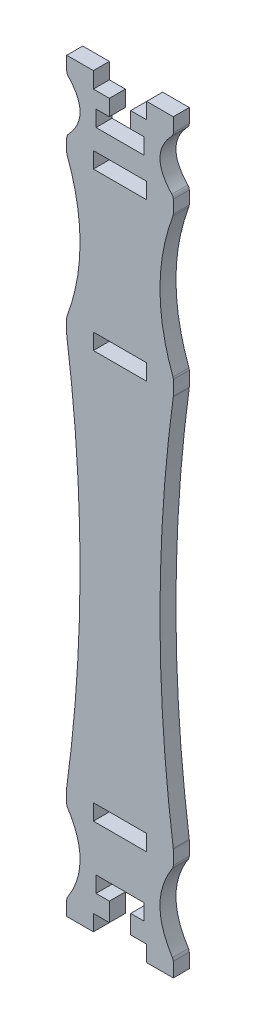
SolidWorks part; units mm, degrees
ref_plane "Alzado" through (0, 0, 0) normal (0, 0, 1) x (1, 0, 0)
ref_plane "Planta" through (0, 0, 0) normal (0, 1, 0) x (1, 0, 0)
ref_plane "Vista lateral" through (0, 0, 0) normal (1, 0, 0) x (0, 0, -1)
sketch "Croquis1" plane through (0, 0, 0) normal (0, 0, 1) x (1, 0, 0)
  line L0 (-15, -70) -> (-10, -70)
  line L1 (-10, 70) -> (-10, 67)
  line L2 (-7, 67) -> (-10, 67)
  line L3 (0, -70) -> (5, -70)
  line L4 (-15, 70) -> (-15, 67.4057)
  line L5 (0, -70) -> (0, -67)
  line L6 (-7, -63.5) -> (-7, -67)
  line L7 (-0.5, -60.5) -> (-9.5, -60.5)
  line L8 (-10, -67) -> (-10, -70)
  line L9 (-10, 70) -> (-15, 70)
  line L10 (-9.5, 61) -> (-0.5, 61)
  line L11 (-10, -52) -> (-10, -49)
  line L12 (-10, -52) -> (0, -52)
  line L13 (-0.5, -60.5) -> (-0.5, -63.5)
  line L14 (-0.5, -63.5) -> (-3, -63.5)
  line L15 (-10, -49) -> (0, -49)
  line L16 (0, -49) -> (0, -52)
  line L17 (-0.5, 61) -> (-0.5, 64)
  line L18 (-3, -63.5) -> (-3, -67)
  line L19 (-0.5, 64) -> (-3, 64)
  line L20 (-10, 27.5) -> (-10, 24.5)
  line L21 (-3, 64) -> (-3, 67)
  line L22 (-10, 24.5) -> (0, 24.5)
  line L23 (0, 24.5) -> (0, 27.5)
  line L24 (-7, 64) -> (-7, 67)
  line L25 (-15, 27.3187) -> (-15, 24.5677)
  line L26 (-9.5, -63.5) -> (-7, -63.5)
  line L27 (-9.5, -60.5) -> (-9.5, -63.5)
  line L28 (-7, -67) -> (-10, -67)
  line L29 (-9.5, 64) -> (-7, 64)
  line L30 (-9.5, 61) -> (-9.5, 64)
  line L31 (-10, 54) -> (-10, 57)
  line L32 (-10, 54) -> (0, 54)
  line L33 (-10, 57) -> (0, 57)
  line L34 (0, 57) -> (0, 54)
  line L35 (-3, 67) -> (0, 67)
  line L37 (0, 67) -> (0, 70)
  line L38 (5, 70) -> (0, 70)
  line L40 (0, 27.5) -> (-10, 27.5)
  line L42 (-15, 56.5943) -> (-15, 54.1813)
  line L43 (0, -67) -> (-3, -67)
  line L46 (-15, -49.0677) -> (-15, -51.7014)
  line L48 (-15, -67.2986) -> (-15, -70)
  line L49 (5, -70) -> (5, -67.2986)
  line L51 (5, -51.7014) -> (5, -49.0677)
  line L53 (5, 24.5677) -> (5, 27.3187)
  line L55 (5, 54.1813) -> (5, 56.5943)
  line L57 (5, 67.4057) -> (5, 70)
  arc A0 (-14.8403, -66.7566) -> (-15, -67.2986) centre (-14, -67.2986) ccw
  arc A1 (5, -67.2986) -> (4.8403, -66.7566) centre (4, -67.2986) ccw
  arc A2 (4.8403, -52.2434) -> (5, -51.7014) centre (4, -51.7014) ccw
  arc A3 (-15, -51.7014) -> (-14.8403, -52.2434) centre (-14, -51.7014) ccw
  arc A4 (-14.9909, -48.9331) -> (-15, -49.0677) centre (-14, -49.0677) ccw
  arc A5 (5, -49.0677) -> (4.9909, -48.9331) centre (4, -49.0677) ccw
  arc A6 (-15, 24.5677) -> (-14.9909, 24.4331) centre (-14, 24.5677) ccw
  arc A7 (4.9909, 24.4331) -> (5, 24.5677) centre (4, 24.5677) ccw
  arc A8 (-14.9371, 27.6678) -> (-15, 27.3187) centre (-14, 27.3187) ccw
  arc A9 (5, 27.3187) -> (4.9371, 27.6678) centre (4, 27.3187) ccw
  arc A10 (-14.7272, 57.2807) -> (-15, 56.5943) centre (-14, 56.5943) ccw
  arc A11 (-15, 54.1813) -> (-14.9371, 53.8322) centre (-14, 54.1813) ccw
  arc A12 (4.9371, 53.8322) -> (5, 54.1813) centre (4, 54.1813) ccw
  arc A13 (5, 56.5943) -> (4.7272, 57.2807) centre (4, 56.5943) ccw
  arc A14 (4.7272, 66.7193) -> (5, 67.4057) centre (4, 67.4057) ccw
  arc A15 (-15, 67.4057) -> (-14.7272, 66.7193) centre (-14, 67.4057) ccw
  spline S0 degree 3 poles (4.7272, 66.7193) (3.2424, 65.1462) (1.7576, 62) (3.2424, 58.8538) (4.7272, 57.2807) knots 0.028065 0.028065 0.028065 0.028065 0.5 0.971935 0.971935 0.971935 0.971935
  spline S1 degree 3 poles (-14.7272, 57.2807) (-13.2424, 58.8538) (-11.7576, 62) (-13.2424, 65.1462) (-14.7272, 66.7193) knots 0.028065 0.028065 0.028065 0.028065 0.5 0.971935 0.971935 0.971935 0.971935
  spline S2 degree 3 poles (-14.9371, 53.8322) (-13.3124, 49.4715) (-11.6876, 40.75) (-13.3124, 32.0285) (-14.9371, 27.6678) knots 0.006333 0.006333 0.006333 0.006333 0.5 0.993667 0.993667 0.993667 0.993667
  spline S3 degree 3 poles (4.9371, 53.8322) (3.3124, 49.4715) (1.6876, 40.75) (3.3124, 32.0285) (4.9371, 27.6678) knots 0.006333 0.006333 0.006333 0.006333 0.5 0.993667 0.993667 0.993667 0.993667
  spline S4 degree 3 poles (-14.9909, -48.9331) (-13.3303, -36.7054) (-11.6697, -12.25) (-13.3303, 12.2054) (-14.9909, 24.4331) knots 0.00091 0.00091 0.00091 0.00091 0.5 0.99909 0.99909 0.99909 0.99909
  spline S5 degree 3 poles (4.8403, -66.7566) (3.2801, -64.3377) (1.7199, -59.5) (3.2801, -54.6623) (4.8403, -52.2434) knots 0.016229 0.016229 0.016229 0.016229 0.5 0.983771 0.983771 0.983771 0.983771
  spline S6 degree 3 poles (-14.8403, -66.7566) (-13.2801, -64.3377) (-11.7199, -59.5) (-13.2801, -54.6623) (-14.8403, -52.2434) knots 0.016229 0.016229 0.016229 0.016229 0.5 0.983771 0.983771 0.983771 0.983771
  spline S7 degree 3 poles (4.9909, -48.9331) (3.3303, -36.7054) (1.6697, -12.25) (3.3303, 12.2054) (4.9909, 24.4331) knots 0.00091 0.00091 0.00091 0.00091 0.5 0.99909 0.99909 0.99909 0.99909
  dimension "D1" = 1
extrude "Saliente-Extruir1" add sketch "Croquis1" along normal blind 3
